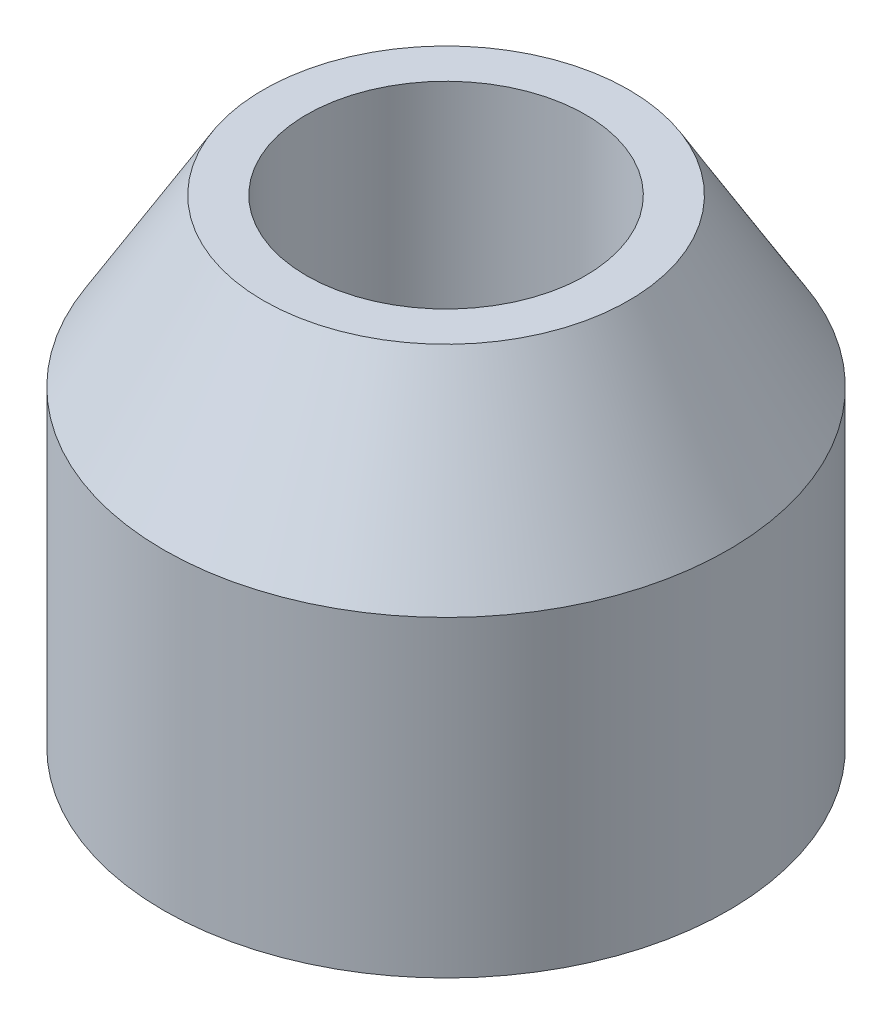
SolidWorks part; units mm, degrees
ref_plane "前视基准面" through (0, 0, 0) normal (0, 0, 1) x (1, 0, 0)
ref_plane "上视基准面" through (0, 0, 0) normal (0, 1, 0) x (1, 0, 0)
ref_plane "右视基准面" through (0, 0, 0) normal (1, 0, 0) x (0, 0, -1)
other "Configuration Table"
sketch "草图1" plane through (0, 0, 0) normal (0, 1, 0) x (1, 0, 0)
  circle A0 centre (0, 0) radius 4.25
  circle A1 centre (0, 0) radius 2.1
  dimension "D1" = 8.5
  dimension "D2" = 4.2
extrude "凸台-拉伸1" add sketch "草图1" along normal blind 7.2
chamfer "倒角1" distance 2.5 distance2 1.5 1 edges at (0, 7.2, 4.25)
